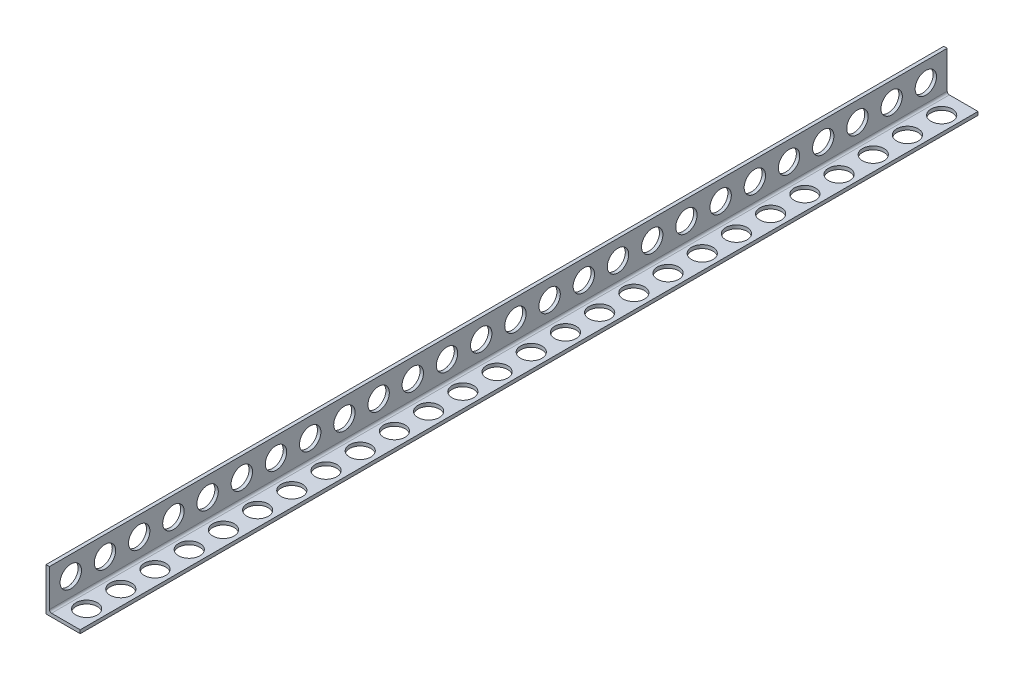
SolidWorks part; units mm, degrees
ref_plane "Front" through (0, 0, 0) normal (0, 0, 1) x (1, 0, 0)
ref_plane "Top" through (0, 0, 0) normal (0, 1, 0) x (1, 0, 0)
ref_plane "Right" through (0, 0, 0) normal (1, 0, 0) x (0, 0, -1)
sketch "Sketch1" plane through (0, 0, 0) normal (0, 0, 1) x (1, 0, 0)
  line L0 (-58.6206, 0) -> (89.271, 0) construction
  line L1 (0, 113.9997) -> (0, -36.1686) construction
  line L2 (-40, 0) -> (40, 0)
  line L3 (-32, 8) -> (40, 8)
  line L4 (-40, 100) -> (-40, 0)
  line L6 (40, 8) -> (40, 0)
  line L11 (-40, 100) -> (-32, 100)
  line L12 (-32, 100) -> (-32, 8)
  dimension "D1" = 80
  dimension "D2" = 40
  dimension "D4" = 8
  dimension "D5" = 8
  dimension "D6" = 100
extrude "Extrude1" add sketch "Sketch1" along normal blind 2100
fillet "Fillet1" radius 5 1 edges at (-32, 8, 1050)
sketch "Sketch2" plane through (-40, 0, 0) normal (-1, 0, 0) x (0, 0, 1)
  line L0 (2100, 100) -> (0, 100) construction
  line L1 (0, 100) -> (0, 0) construction
  circle A0 centre (50, 55) radius 25
  dimension "D1" = 50
  dimension "D2" = 45
  dimension "D3" = 50
extrude "Cut-Extrude1" cut sketch "Sketch2" against normal through all
sketch "Sketch3" plane through (0, 8, 0) normal (0, 1, 0) x (-1, 0, 0)
  line L0 (32, 50) -> (40, 50) construction
  line L2 (-40, 2100) -> (-40, 0) construction
  circle A0 centre (-5, 50) radius 25
  dimension "D1" = 50
  dimension "D2" = 35
extrude "Cut-Extrude2" cut sketch "Sketch3" against normal through all
pattern_linear "LPattern1" count 26 spacing 80 along (0, 0, 1) of "Cut-Extrude1", "Cut-Extrude2"
equation "\"D1@Extrude1\" = \"D1@LPattern1\" * \"D3@LPattern1\"+20"
